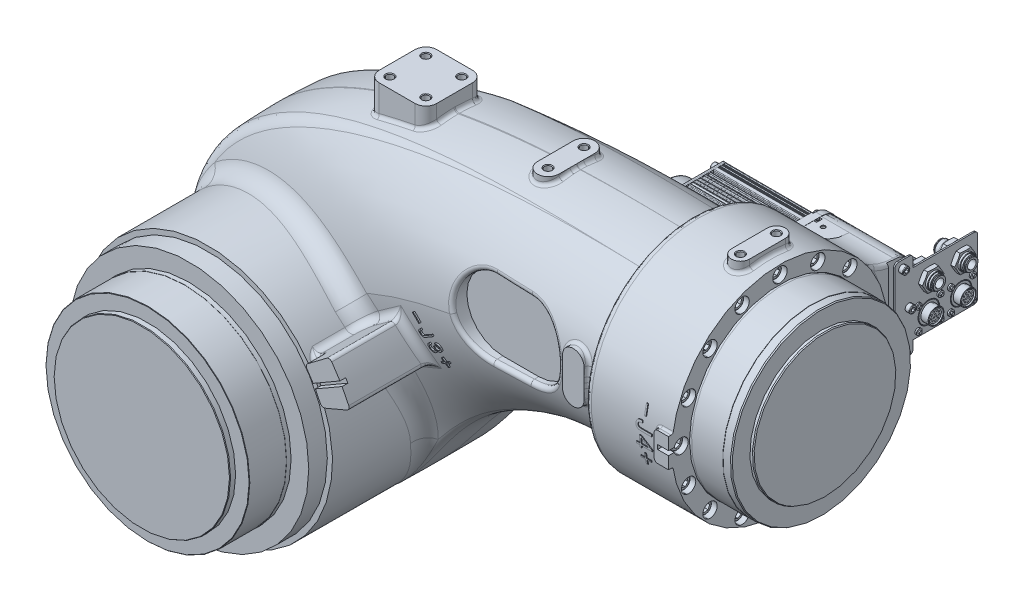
SolidWorks part; units mm, degrees
ref_plane "前视基准面" through (0, 0, 0) normal (0, 0, 1) x (1, 0, 0)
ref_plane "上视基准面" through (0, 0, 0) normal (0, 1, 0) x (1, 0, 0)
ref_plane "右视基准面" through (0, 0, 0) normal (1, 0, 0) x (0, 0, -1)
imported_body "肘部装配A-1-solid1"
sketch "草图1" plane through (483.4, 0, 0) normal (-1, 0, 0) x (0, 0, 1)
  line L1 (-197.0725, 66.598) -> (-63.6775, 66.598)
  line L2 (-197.0725, 66.598) -> (-197.0725, -66.598)
  line L3 (-197.0725, -66.598) -> (-63.6775, -66.598)
  line L4 (-63.6775, 66.598) -> (-63.6775, -66.598)
  line L5 (-197.0725, 66.598) -> (-63.6775, -66.598) construction
  line L6 (-197.0725, -66.598) -> (-63.6775, 66.598) construction
  point P0 (-130.375, 0)
surface "曲面-基准面1" sketch "草图1"
split "分割1" trim tools "曲面-基准面1" bodies to split 122 resulting bodies 124 125
sketch "草图2" plane through (0, 0, 42.5) normal (0, 0, -1) x (-1, 0, 0)
  line L1 (-92.3041, -107.0823) -> (92.3041, -107.0823)
  line L2 (-92.3041, -107.0823) -> (-92.3041, -292.9177)
  line L3 (-92.3041, -292.9177) -> (92.3041, -292.9177)
  line L4 (92.3041, -107.0823) -> (92.3041, -292.9177)
  line L5 (-92.3041, -107.0823) -> (92.3041, -292.9177) construction
  line L6 (-92.3041, -292.9177) -> (92.3041, -107.0823) construction
  point P0 (0, -200)
surface "曲面-基准面2" sketch "草图2"
split "分割2" trim tools "曲面-基准面2" bodies to split 124 125 resulting bodies 127 128 129
